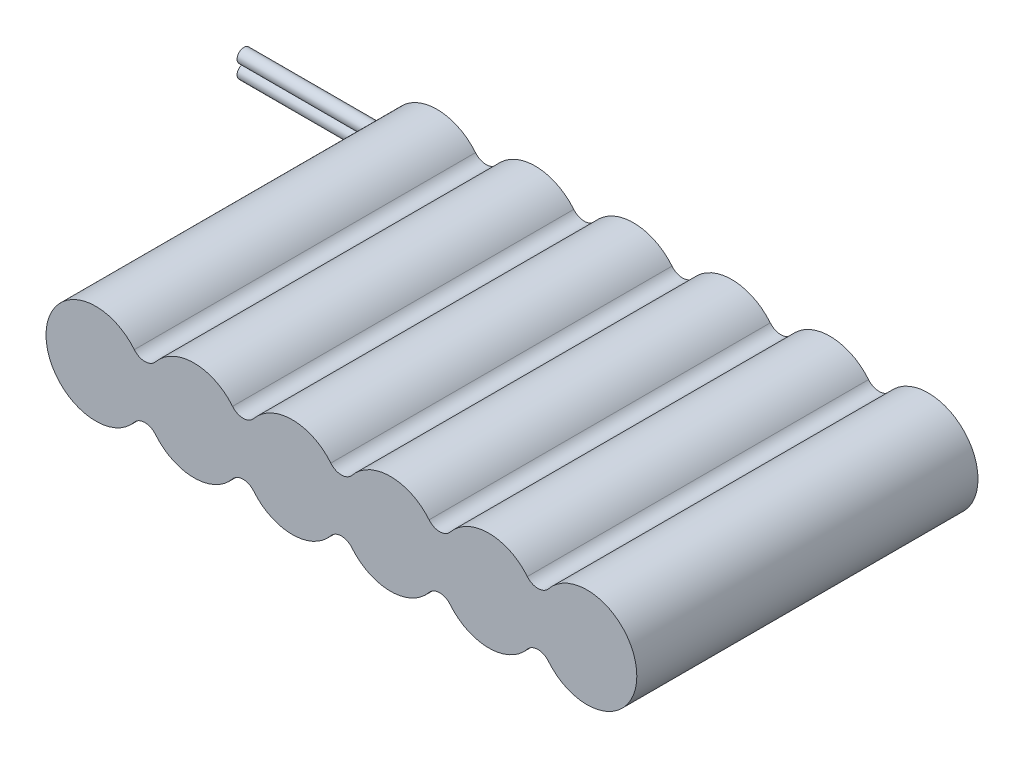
SolidWorks part; units mm, degrees
ref_plane "Front Plane" through (0, 0, 0) normal (0, 0, 1) x (1, 0, 0)
ref_plane "Top Plane" through (0, 0, 0) normal (0, 1, 0) x (1, 0, 0)
ref_plane "Right Plane" through (0, 0, 0) normal (1, 0, 0) x (0, 0, -1)
sketch "Sketch1" plane through (0, 0, 0) normal (0, 0, 1) x (1, 0, 0)
  circle A0 centre (0, 0) radius 9.2604
  circle A1 centre (18.288, 0) radius 9.2604
  circle A2 centre (36.576, 0) radius 9.2604
  circle A3 centre (54.864, 0) radius 9.2604
  circle A4 centre (73.152, 0) radius 9.2604
  circle A5 centre (91.44, 0) radius 9.2604
  circle A12 centre (91.44, 18.288) radius 9.2604
  circle A13 centre (73.152, 18.288) radius 9.2604
  circle A14 centre (54.864, 18.288) radius 9.2604
  circle A15 centre (36.576, 18.288) radius 9.2604
  circle A16 centre (18.288, 18.288) radius 9.2604
  circle A17 centre (0, 18.288) radius 9.2604
  dimension "D1" = 18.5208
  dimension "D2" = 6
  dimension "D3" = 2
extrude "Boss-Extrude4" add sketch "Sketch1" along normal blind 63.5
fillet "Fillet1" radius 2.54 10 edges at (82.296, 1.4638, 31.75) (82.296, -1.4638, 31.75) (64.008, -1.4638, 31.75) (64.008, 1.4638, 31.75) (45.72, 1.4638, 31.75) (45.72, -1.4638, 31.75) (27.432, 1.4638, 31.75) (27.432, -1.4638, 31.75) (9.144, 1.4638, 31.75) (9.144, -1.4638, 31.75)
ref_plane "Plane1" through (-9.2604, 0, 0) normal (-1, 0, 0) x (0, 0, 1)
sketch "Sketch2" plane through (-9.2604, 0, 0) normal (-1, 0, 0) x (0, 0, 1)
  line L0 (0, 0) -> (10.3182, 0) construction
  line L1 (0, 9.2604) -> (0, -9.2604) construction
  line L4 (1.1204, 0.0088) -> (1.1204, -0.0088)
  line L6 (1.4196, 0.0088) -> (1.4196, -0.0088)
  arc A0 (1.4196, 0.0088) -> (1.1204, 0.0088) centre (1.27, 1.27) ccw
  arc A1 (1.1204, -0.0088) -> (1.4196, -0.0088) centre (1.27, -1.27) ccw
  point P9 (1.27, 0)
extrude "Boss-Extrude5" add sketch "Sketch2" along normal blind 25.4 separate body
ref_plane "Plane2" through (100.7004, 0, 0) normal (1, 0, 0) x (0, 0, -1)
